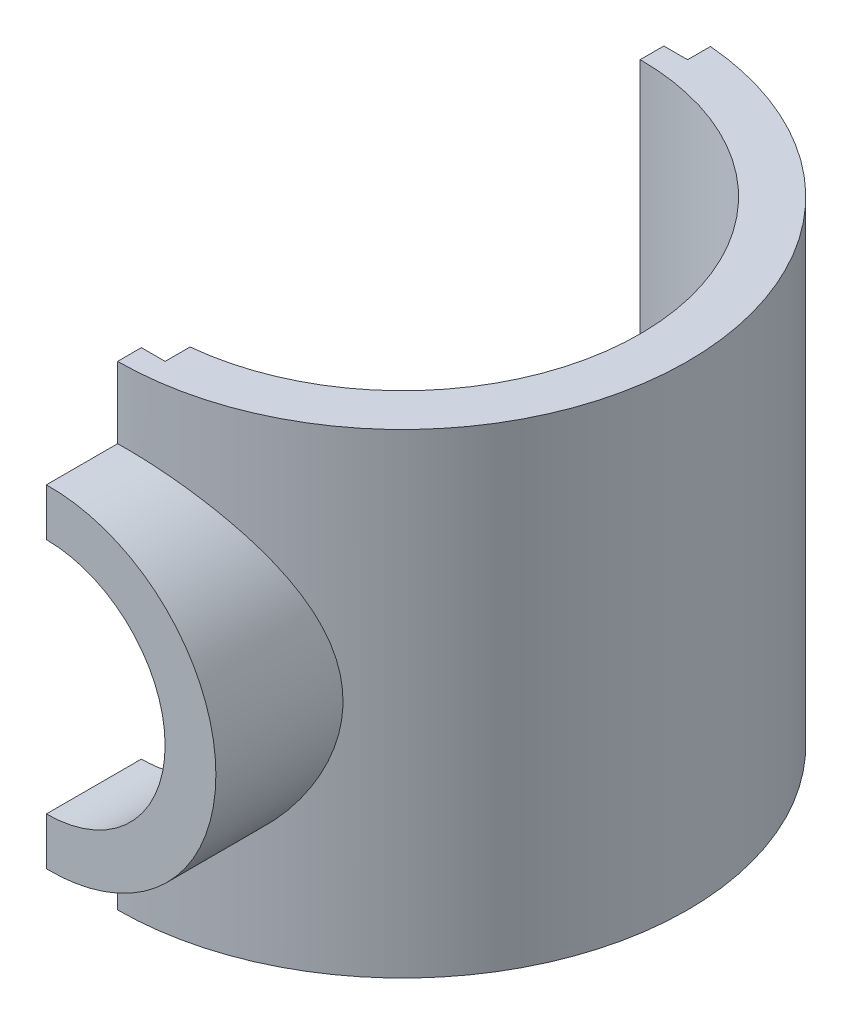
SolidWorks part; units mm, degrees
ref_plane "Front Plane" through (0, 0, 0) normal (0, 0, 1) x (1, 0, 0)
ref_plane "Top Plane" through (0, 0, 0) normal (0, 1, 0) x (1, 0, 0)
ref_plane "Right Plane" through (0, 0, 0) normal (1, 0, 0) x (0, 0, -1)
sketch "Sketch1" plane through (0, 0, 0) normal (0, 1, 0) x (1, 0, 0)
  line L0 (0, 0) -> (0, 16.9714) construction
  line L1 (0, 10) -> (0, 12)
  line L2 (0, -10) -> (0, -12)
  circle A0 centre (0, 0) radius 10 construction
  circle A1 centre (0, 0) radius 12 construction
  arc A2 (0, -10) -> (0, 10) centre (0, 0) ccw
  arc A3 (0, -12) -> (0, 12) centre (0, 0) ccw
extrude "Boss-Extrude1" add sketch "Sketch1" along normal blind 20
ref_plane "Plane1" through (0, 0, 12) normal (0, 0, 1) x (1, 0, 0)
sketch "Sketch3" plane through (0, 0, 12) normal (0, 0, 1) x (1, 0, 0)
  line L0 (0, 20) -> (0, 0) construction
  line L1 (0, 16.9986) -> (0, 15)
  line L2 (0, 5) -> (0, 3.0014)
  circle A0 centre (0, 10) radius 5 construction
  circle A1 centre (0.1376, 10) radius 7 construction
  arc A2 (0, 16.9986) -> (0, 3.0014) centre (0.1376, 10) cw
  arc A3 (0, 5) -> (0, 15) centre (0, 10) ccw
extrude "Boss-Extrude2" add sketch "Sketch3" along normal blind 3 and the other way up to surface
sketch "Sketch5" plane through (0, 0, 0) normal (0, 1, 0) x (1, 0, 0)
  line L1 (1, 12.0623) -> (-0.0876, 12.0623)
  line L2 (1, 12.0623) -> (1, 10.9951)
  line L3 (1, 10.9951) -> (-0.0876, 10.9951)
  line L4 (-0.0876, 12.0623) -> (-0.0876, 10.9951)
  line L5 (1, -8.9996) -> (-0.2371, -8.9996)
  line L6 (1, -8.9996) -> (1, -10.9996)
  line L7 (1, -10.9996) -> (-0.2371, -10.9996)
  line L8 (-0.2371, -8.9996) -> (-0.2371, -10.9996)
  point P10 (0, 0)
sketch "Sketch4" plane through (0, 0, 12) normal (0, 0, 1) x (1, 0, 0)
  circle A2 centre (0, 10) radius 5
extrude "Cut-Extrude1" cut sketch "Sketch4" against normal blind 13
extrude "Cut-Extrude5" cut sketch "Sketch5" along normal blind 20
